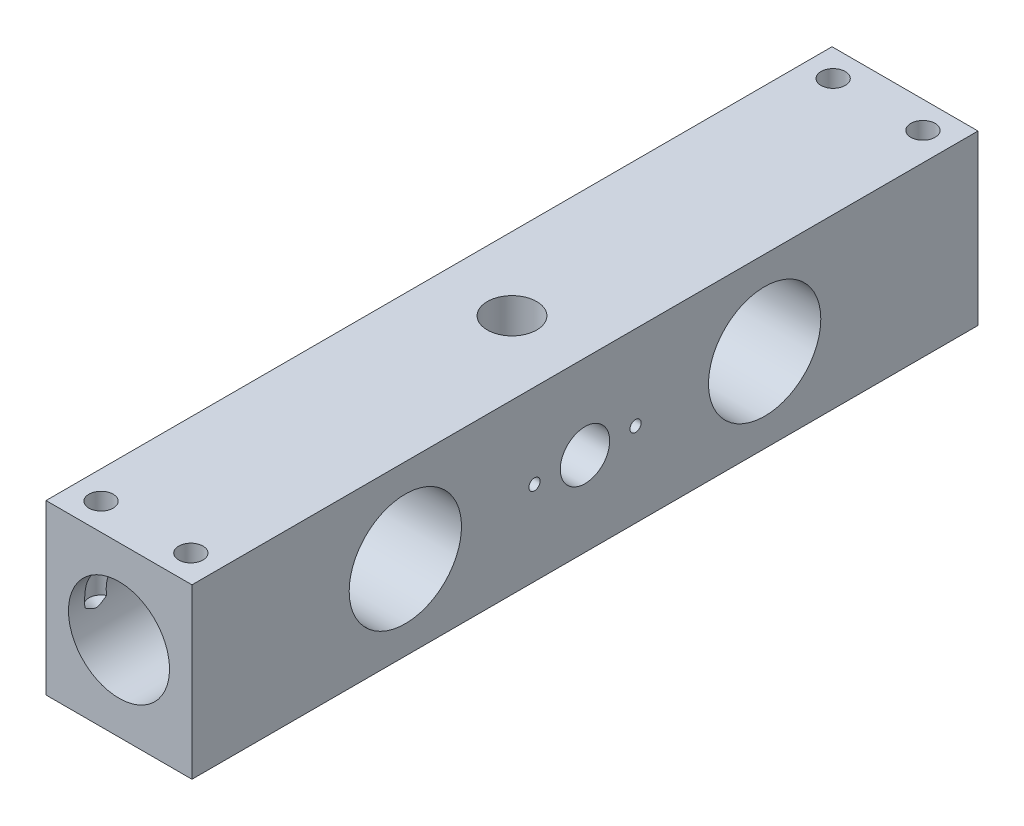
SolidWorks part; units mm, degrees
ref_plane "Plan de face" through (0, 0, 0) normal (0, 0, 1) x (1, 0, 0)
ref_plane "Plan de dessus" through (0, 0, 0) normal (0, 1, 0) x (1, 0, 0)
ref_plane "Plan de droite" through (0, 0, 0) normal (1, 0, 0) x (0, 0, -1)
sketch "Esquisse1" plane through (0, 0, 0) normal (0, 0, 1) x (1, 0, 0)
  line L1 (0, 0) -> (65, 0)
  line L2 (0, 0) -> (0, 75)
  line L3 (0, 75) -> (65, 75)
  line L4 (65, 0) -> (65, 75)
  dimension "D1" = 65
  dimension "D2" = 75
extrude "Extrusion1" add sketch "Esquisse1" against normal blind 175
sketch "Esquisse2" plane through (65, 0, 0) normal (1, 0, 0) x (0, 0, -1)
  line L0 (175, 0) -> (0, 0) construction
  line L1 (0, 0) -> (0, 75) construction
  circle A0 centre (80, 37.5) radius 25
  dimension "D1" = 37.5
  dimension "D2" = 80
extrude "Enlèv. mat.-Extru.1" cut sketch "Esquisse2" against normal through all
hole_wizard "Diamètre du perçage M25.0 (25)1" positions "Esquisse4" profile "Esquisse3" hole size "M25.0" standard "Ansi Métrique"
sketch "Esquisse4" plane through (0, 0, -175) normal (0, 0, -1) x (-1, 0, 0)
  line L0 (0, 0) -> (-65, 0) construction
  line L1 (0, 75) -> (0, 0) construction
  point P0 (-32.5, 37.5)
  dimension "D1" = 37.5
  dimension "D2" = 32.5
sketch "Esquisse3" plane through (32.5, 37.5, -175) normal (1, 0, 0) x (0, 1, 0)
  line L0 (0, 0) -> (0, 65.5194)
  line L1 (0, 65.5194) -> (22.5, 52)
  line L2 (22.5, 52) -> (22.5, 0)
  line L5 (22.5, 0) -> (0, 0)
  line L10 (0, 65.5194) -> (-22.5, 52) construction
  line L11 (0, -6.35) -> (0, 107.95) construction
  dimension "Diamètre du perçage" = 45
  dimension "Profondeur du perçage" = 52
  dimension "Angle de pointe" = 118
hole_wizard "Trou taraudé M12x1.251" positions "Esquisse6" profile "Esquisse5" tap size "M12x1.25" standard "Ansi Métrique"
sketch "Esquisse6" plane through (0, 75, 0) normal (0, 1, 0) x (-1, 0, 0)
  line L0 (-65, -175) -> (0, -175) construction
  line L9 (-32.5, -175) -> (-32.5, -137.8931) construction
  point P0 (-52.5, -163)
  dimension "D1" = 12
  dimension "D2" = 20
sketch "Esquisse5" plane through (52.5, 75, -163) normal (1, 0, 0) x (0, 0, 1)
  line L0 (0, 0) -> (0, 41.9946)
  line L1 (0, 41.9946) -> (5.4, 38.75)
  line L2 (5.4, 38.75) -> (5.4, 0)
  line L5 (5.4, 0) -> (0, 0)
  line L10 (0, 41.9946) -> (-5.4, 38.75) construction
  line L11 (0, -6.35) -> (0, 107.95) construction
  dimension "Diamètre du trou pour taraudage" = 10.8
  dimension "Profondeur du trou pour taraudage" = 38.75
  dimension "Angle de pointe" = 118
hole_wizard "Trou taraudé M12x1.252" positions "Esquisse9" profile "Esquisse8" tap size "M12x1.25" standard "Ansi Métrique"
sketch "Esquisse9" plane through (0, 75, 0) normal (0, 1, 0) x (-1, 0, 0)
  line L0 (-65, -175) -> (0, -175) construction
  line L1 (-32.5, -175) -> (-32.5, -135.8748) construction
  point P0 (-12.5, -163)
  dimension "D1" = 12
  dimension "D2" = 20
sketch "Esquisse8" plane through (12.5, 75, -163) normal (1, 0, 0) x (0, 0, 1)
  line L0 (0, 0) -> (0, 43.2446)
  line L1 (0, 43.2446) -> (5.4, 40)
  line L2 (5.4, 40) -> (5.4, 0)
  line L5 (5.4, 0) -> (0, 0)
  line L10 (0, 43.2446) -> (-5.4, 40) construction
  line L11 (0, -6.35) -> (0, 107.95) construction
  dimension "Diamètre du trou pour taraudage" = 10.8
  dimension "Profondeur du trou pour taraudage" = 40
  dimension "Angle de pointe" = 118
hole_wizard "Trou taraudé M12x1.253" positions "Esquisse3D2" profile "Esquisse12" tap size "M12x1.25" standard "Ansi Métrique"
sketch3d "Esquisse3D2"
  line L0 (0, 0, 0) -> (65, 0, 0) construction
  line L4 (32.5, 0, -175) -> (32.5, 0, -113.9084) construction
  line L5 (0, 0, -175) -> (65, 0, -175) construction
  point P0 (10, 0, -112)
  point P2 (55, 0, -112)
  dimension "D1" = 112
  dimension "D2" = 112
  dimension "D3" = 45
  dimension "D4" = 22.5
sketch "Esquisse12" plane through (10, 0, -112) normal (1, 0, 0) x (0, 0, -1)
  line L0 (0, 0) -> (0, 36.9946)
  line L1 (0, 36.9946) -> (5.4, 33.75)
  line L2 (5.4, 33.75) -> (5.4, 0)
  line L5 (5.4, 0) -> (0, 0)
  line L10 (0, 36.9946) -> (-5.4, 33.75) construction
  line L11 (0, -6.35) -> (0, 107.95) construction
  dimension "Diamètre du trou pour taraudage" = 10.8
  dimension "Profondeur du trou pour taraudage" = 33.75
  dimension "Angle de pointe" = 118
hole_wizard "Trou taraudé M6x1.01" positions "Esquisse3D3" profile "Esquisse13" tap size "M6x1.0" standard "Ansi Métrique"
sketch3d "Esquisse3D3"
  line L0 (0, 75, 0) -> (0, 0, 0) construction
  line L1 (0, 75, -175) -> (0, 75, 0) construction
  line L2 (65, 0, 0) -> (65, 75, 0) construction
  line L3 (65, 75, -175) -> (65, 75, 0) construction
  point P0 (65, 37.5, -22.5)
  point P2 (0, 37.5, -18)
  dimension "D1" = 18
  dimension "D2" = 37.5
  dimension "D3" = 22.5
  dimension "D4" = 37.5
sketch "Esquisse13" plane through (65, 37.5, -22.5) normal (0, 1, 0) x (0, 0, -1)
  line L0 (0, 0) -> (0, 16.5022)
  line L1 (0, 16.5022) -> (2.5, 15)
  line L2 (2.5, 15) -> (2.5, 0)
  line L5 (2.5, 0) -> (0, 0)
  line L10 (0, 16.5022) -> (-2.5, 15) construction
  line L11 (0, -6.35) -> (0, 107.95) construction
  dimension "Diamètre du trou pour taraudage" = 5
  dimension "Profondeur du trou pour taraudage" = 15
  dimension "Angle de pointe" = 118
hole_wizard "Diamètre du perçage M12.0 (12)3" positions "Esquisse15" profile "Esquisse14" hole size "M12.0" standard "Ansi Métrique"
sketch "Esquisse15" plane through (0, 0, 0) normal (0, -1, 0) x (1, 0, 0)
  line L0 (0, 0) -> (65, 0) construction
  line L1 (65, -175) -> (65, 0) construction
  point P0 (32.5, -24)
  dimension "D1" = 24
  dimension "D2" = 32.5
sketch "Esquisse14" plane through (32.5, 0, -24) normal (1, 0, 0) x (0, 0, -1)
  line L0 (0, 0) -> (0, 33.6052)
  line L1 (0, 33.6052) -> (6, 30)
  line L2 (6, 30) -> (6, 0)
  line L5 (6, 0) -> (0, 0)
  line L10 (0, 33.6052) -> (-6, 30) construction
  line L11 (0, -6.35) -> (0, 107.95) construction
  dimension "Diamètre du perçage" = 12
  dimension "Profondeur du perçage" = 30
  dimension "Angle de pointe" = 118
mirror "Symétrie1" about plane through (0, 75, 0) normal (0, 0, -1)
hole_wizard "Diamètre du perçage M22.0 (22)1" positions "Esquisse17" profile "Esquisse16" hole size "M22.0" standard "Ansi Métrique"
sketch "Esquisse17" plane through (0, 0, 0) normal (0, -1, 0) x (1, 0, 0)
  line L0 (65, -175) -> (65, 175) construction
  point P0 (32.5, 0)
  dimension "D1" = 32.5
sketch "Esquisse16" plane through (32.5, 0, 0) normal (1, 0, 0) x (0, 0, -1)
  line L0 (0, 0) -> (0, 75)
  line L1 (0, 75) -> (11, 75)
  line L2 (11, 75) -> (11, 0)
  line L5 (11, 0) -> (0, 0)
  line L11 (0, -6.35) -> (0, 107.95) construction
  dimension "Diamètre du perçage jusqu'au prochain" = 22
  dimension "Profondeur du perçage jusqu'au prochain" = 75
hole_wizard "Diamètre du perçage M22.0 (22)2" positions "Esquisse19" profile "Esquisse18" hole size "M22.0" standard "Ansi Métrique"
sketch "Esquisse19" plane through (65, 0, 0) normal (1, 0, 0) x (0, 0, -1)
  line L0 (175, 0) -> (-175, 0) construction
  point P0 (0, 37.5)
  dimension "D1" = 37.5
sketch "Esquisse18" plane through (65, 37.5, 0) normal (0, 1, 0) x (0, 0, -1)
  line L0 (0, 0) -> (0, 39.1095)
  line L1 (0, 39.1095) -> (11, 32.5)
  line L2 (11, 32.5) -> (11, 0)
  line L5 (11, 0) -> (0, 0)
  line L10 (0, 39.1095) -> (-11, 32.5) construction
  line L11 (0, -6.35) -> (0, 107.95) construction
  dimension "Diamètre du perçage" = 22
  dimension "Profondeur du perçage" = 32.5
  dimension "Angle de pointe" = 118
